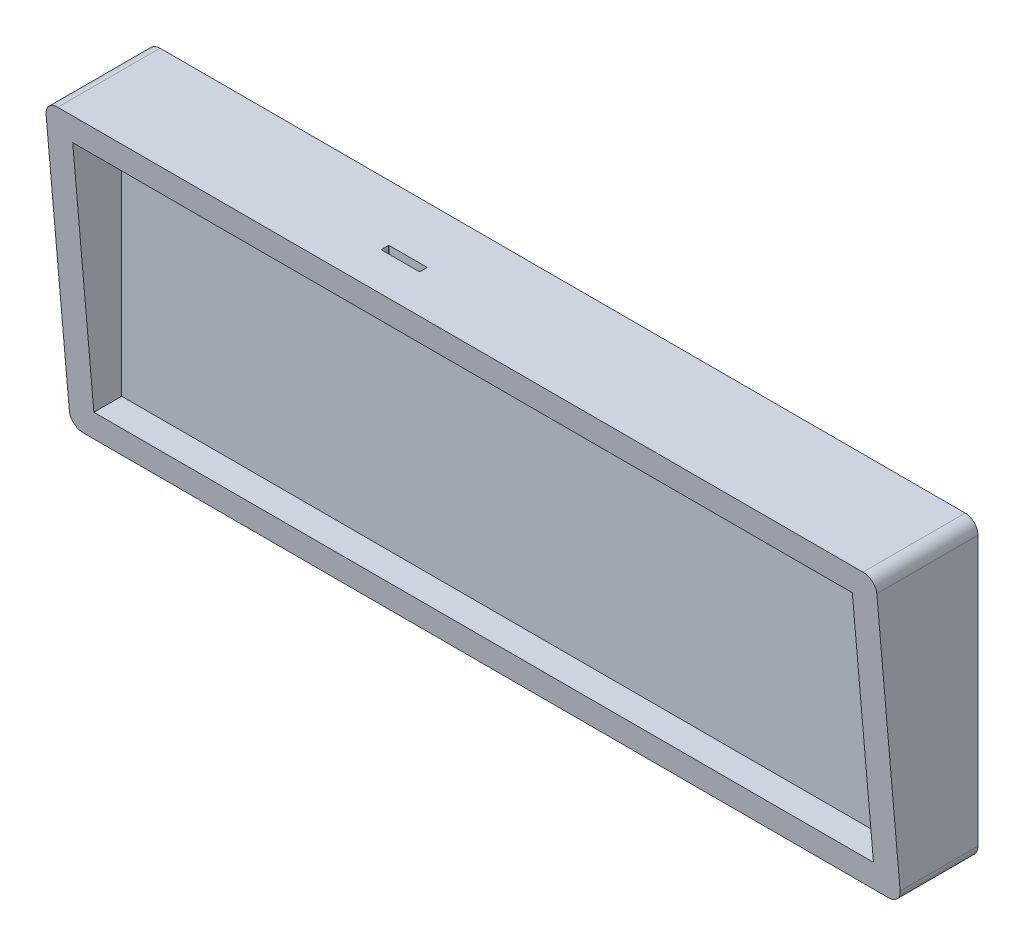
SolidWorks part; units mm, degrees
ref_plane "Front Plane" through (0, 0, 0) normal (0, 0, 1) x (1, 0, 0)
ref_plane "Top Plane" through (0, 0, 0) normal (0, 1, 0) x (1, 0, 0)
ref_plane "Right Plane" through (0, 0, 0) normal (1, 0, 0) x (0, 0, -1)
sketch "Sketch2" plane through (0, 0, 0) normal (0, 0, 1) x (1, 0, 0)
  line L1 (-162.4, -57.625) -> (162.4, -57.625)
  line L2 (-162.4, -57.625) -> (-162.4, 57.625)
  line L3 (-162.4, 57.625) -> (162.4, 57.625)
  line L4 (162.4, -57.625) -> (162.4, 57.625)
  line L5 (-162.4, -57.625) -> (162.4, 57.625) construction
  line L6 (-162.4, 57.625) -> (162.4, -57.625) construction
  point P0 (0, 0)
  dimension "D1" = 115.25
  dimension "D2" = 324.8
extrude "Boss-Extrude1" add sketch "Sketch2" along normal blind 40
sketch "Sketch3" plane through (0, 0, 40) normal (0, 0, 1) x (1, 0, 0)
  line L1 (-152.4, -47.725) -> (152.4, -47.725)
  line L2 (-152.4, -47.725) -> (-152.4, 47.725)
  line L3 (-152.4, 47.725) -> (152.4, 47.725)
  line L4 (152.4, -47.725) -> (152.4, 47.725)
  line L5 (-152.4, -47.725) -> (152.4, 47.725) construction
  line L6 (-152.4, 47.725) -> (152.4, -47.725) construction
  point P0 (0, 0)
  dimension "D1" = 95.45
  dimension "D2" = 304.8
extrude "Cut-Extrude1" cut sketch "Sketch3" against normal blind 20
sketch "Sketch4" plane through (-162.4, 0, 0) normal (-1, 0, 0) x (0, 0, 1)
  line L0 (30, -57.625) -> (40, 57.625)
  line L1 (40, -57.625) -> (0, -57.625) construction
  line L2 (0, 57.625) -> (0, -57.625) construction
  line L3 (40, 57.625) -> (40, -57.625)
  line L4 (40, -57.625) -> (30, -57.625)
  dimension "D1" = 30
extrude "Cut-Extrude2" cut sketch "Sketch4" against normal blind 324.8
sketch "Sketch5" plane through (0, 57.625, 0) normal (0, 1, 0) x (1, 0, 0)
  line L0 (-162.4, -40) -> (-162.4, 0) construction
  line L1 (-45.95, -25) -> (-30.95, -25)
  line L2 (-45.95, -25) -> (-45.95, -22)
  line L3 (-45.95, -22) -> (-30.95, -22)
  line L4 (-30.95, -25) -> (-30.95, -22)
  line L7 (162.4, -40) -> (-162.4, -40) construction
  point P0 (-33.7, -20)
  point P9 (0, 0)
  dimension "D1" = 116.45
  dimension "D2" = 15
  dimension "D3" = 3
  dimension "D4" = 15
extrude "Cut-Extrude6" cut sketch "Sketch5" against normal blind 50 contours L2 L1 L4 L3
fillet "Fillet2" radius 5 4 edges at (162.4, -57.625, 15) (162.4, 57.625, 20) (-162.4, -57.625, 15) (-162.4, 57.625, 20)
fillet "Fillet3" radius 0.1 1 edges at (-45.95, 52.675, 25)
fillet "Fillet4" radius 0.1 1 edges at (-30.95, 52.675, 22)
fillet "Fillet5" radius 0.1 1 edges at (-30.95, 52.675, 25)
fillet "Fillet6" radius 0.1 1 edges at (-45.95, 52.675, 22)
